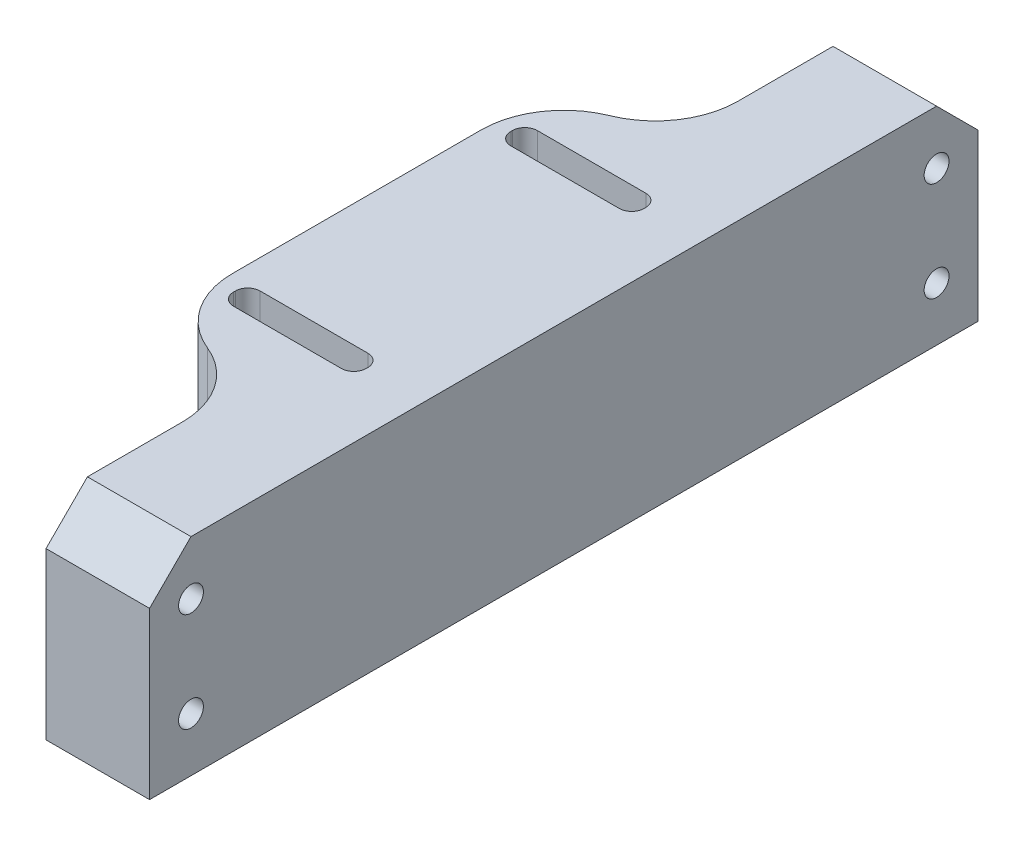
SolidWorks part; units mm, degrees
ref_plane "Спереди" through (0, 0, 0) normal (0, 0, 1) x (1, 0, 0)
ref_plane "Сверху" through (0, 0, 0) normal (0, 1, 0) x (1, 0, 0)
ref_plane "Справа" through (0, 0, 0) normal (1, 0, 0) x (0, 0, -1)
sketch "Эскиз1" plane through (0, 0, 0) normal (0, 1, 0) x (1, 0, 0)
  line L0 (-12.5, 16.75) -> (12.5, 16.75) construction
  line L1 (-12.5, -25) -> (0, -25)
  line L2 (0, -25) -> (0, -50)
  line L3 (0, -50) -> (12.5, -50)
  line L4 (-12.5, -25) -> (-12.5, 25)
  line L5 (12.5, -25) -> (-12.5, 25) construction
  line L6 (12.5, 25) -> (-12.5, -25) construction
  line L7 (-12.5, -16.75) -> (12.5, -16.75) construction
  line L8 (0, 25) -> (0, -25) construction
  line L9 (-2.5, -25) -> (-2.5, 25) construction
  line L11 (5.5, -15.15) -> (-10.5, -15.15)
  line L12 (5.5, -15.15) -> (5.5, -18.35)
  line L13 (5.5, -18.35) -> (-10.5, -18.35)
  line L14 (-10.5, -15.15) -> (-10.5, -18.35)
  line L15 (5.5, -15.15) -> (-10.5, -18.35) construction
  line L16 (5.5, -18.35) -> (-10.5, -15.15) construction
  line L17 (5.5477, 18.35) -> (-10.5477, 18.35)
  line L18 (5.5477, 18.35) -> (5.5477, 15.15)
  line L19 (5.5477, 15.15) -> (-10.5477, 15.15)
  line L20 (-10.5477, 18.35) -> (-10.5477, 15.15)
  line L21 (5.5477, 18.35) -> (-10.5477, 15.15) construction
  line L22 (5.5477, 15.15) -> (-10.5477, 18.35) construction
  line L23 (0, 25) -> (0, 50)
  line L24 (0, 50) -> (12.5, 50)
  line L25 (12.5, -50) -> (12.5, 50)
  line L26 (0, 25) -> (-12.5, 25)
  line L27 (12.5, 25) -> (-12.5, 25) construction
  line L28 (-12.5, -25) -> (12.5, -25) construction
  point P0 (0, 0)
  point P10 (0, 16.75)
  point P13 (-2.5, -16.75)
  point P15 (0, -16.75)
  point P19 (-2.5, 16.75)
  point P23 (0, 0)
  dimension "D1" = 10
  dimension "D2" = 3.2
  dimension "D3" = 25
  dimension "D4" = 33.5
  dimension "D5" = 50
  dimension "D6" = 100
  dimension "D7" = 16
extrude "Бобышка-Вытянуть1" add sketch "Эскиз1" along normal blind 25
sketch "Эскиз2" plane through (0, 0, 0) normal (-1, 0, 0) x (0, 0, 1)
  line L0 (-45, 0) -> (-45, 25) construction
  line L2 (-50, 0) -> (-25, 0) construction
  line L3 (-50, 25) -> (-25, 25) construction
  circle A0 centre (-45, 6.5) radius 1.5
  circle A1 centre (-45, 18.5) radius 1.5
  point P11 (-45, 12.5)
  dimension "D1" = 12
  dimension "D3" = 3
  dimension "D2" = 6
  dimension "D4" = 5
extrude "Вырез-Вытянуть1" cut sketch "Эскиз2" against normal through all
sketch "Эскиз3" plane through (0, 0, 0) normal (-1, 0, 0) x (0, 0, 1)
  line L0 (45, 0) -> (45, 25) construction
  line L3 (25, 0) -> (50, 0) construction
  line L4 (25, 25) -> (50, 25) construction
  circle A0 centre (45, 6.5) radius 1.5
  circle A1 centre (45, 18.5) radius 1.5
  point P10 (45, 12.5)
  dimension "D3" = 3
  dimension "D1" = 12
  dimension "D2" = 6
  dimension "D4" = 5
extrude "Вырез-Вытянуть2" cut sketch "Эскиз3" against normal through all
fillet "Скругление6" radius 10 2 edges at (-12.5, 12.5, 25) (-12.5, 12.5, -25)
fillet "Скругление7" radius 1.5 8 edges at (5.5, 12.5, 15.15) (5.5, 12.5, 18.35) (-10.5, 12.5, 18.35) (-10.5, 12.5, 15.15) (-10.5477, 12.5, -15.15) (-10.5477, 12.5, -18.35) (5.5477, 12.5, -18.35) (5.5477, 12.5, -15.15)
chamfer "Фаска1" distance 5 angle 45 2 edges at (6.25, 25, 50) (6.25, 25, -50)
fillet "Скругление8" radius 10 2 edges at (0, 12.5, 25) (0, 12.5, -25)
sketch "Sketch1" plane through (0, 0, 0) normal (0, -1, 0) x (1, 0, 0)
  line L0 (-12.5, 20.75) -> (8.5, 20.75)
  line L1 (-12.5, -15) -> (-12.5, 15) construction
  line L2 (12.5, 50) -> (12.5, -50) construction
  line L3 (8.5, 20.75) -> (8.5, 12.75)
  line L4 (-12.5, 12.75) -> (-12.5, 20.75)
  line L5 (8.5, 12.75) -> (-12.5, 12.75)
  line L6 (-12.5, -12.75) -> (8.5, -12.75)
  line L7 (8.5, -12.75) -> (8.5, -20.75)
  line L8 (8.5, -20.75) -> (-12.5, -20.75)
  line L9 (-12.5, -20.75) -> (-12.5, -12.75)
  line L10 (-12.5, 16.75) -> (14, 16.75) construction
  line L11 (0.75, 18.35) -> (0.75, 15.15) construction
  line L14 (-12.5, -16.75) -> (14, -16.75) construction
  line L15 (-9, 18.35) -> (4, 18.35) construction
  line L16 (0.75, -15.15) -> (0.75, -18.35) construction
  line L19 (4, 15.15) -> (-9, 15.15) construction
  line L20 (4.0477, -18.35) -> (-9.0477, -18.35) construction
  line L21 (-9.0477, -15.15) -> (4.0477, -15.15) construction
  point P1 (0, 0)
  point P20 (0, 0)
  point P21 (0, 0)
  point P22 (0.75, 16.75)
  point P23 (0.75, 16.75)
  point P24 (0, 0)
  point P25 (0.75, -16.75)
  point P29 (0, 0)
  point P30 (0, 0)
  point P33 (0.75, -16.75)
  point P36 (0, 0)
  point P39 (0, 0)
  dimension "D1" = 4
  dimension "D2" = 8
extrude "Cut-Extrude1" cut sketch "Sketch1" against normal blind 7
